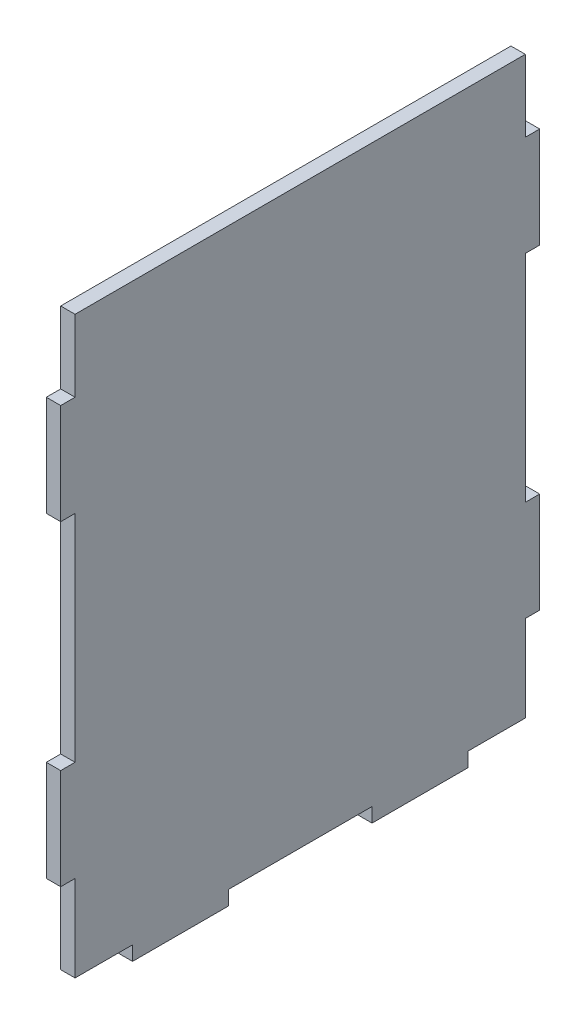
SolidWorks part; units mm, degrees
ref_plane "Front Plane" through (0, 0, 0) normal (0, 0, 1) x (1, 0, 0)
ref_plane "Top Plane" through (0, 0, 0) normal (0, 1, 0) x (1, 0, 0)
ref_plane "Right Plane" through (0, 0, 0) normal (1, 0, 0) x (0, 0, -1)
sketch "草图1" plane through (0, 0, 0) normal (1, 0, 0) x (0, 0, -1)
  line L0 (-50, 60) -> (-50, -60)
  line L1 (-50, -60) -> (50, -60)
  line L2 (50, -60) -> (50, 60)
  line L3 (50, 60) -> (-50, 60)
  point P4 (0, 60)
  point P5 (-50, 0)
  dimension "D1" = 120
  dimension "D2" = 100
extrude "凸台-拉伸1" add sketch "草图1" along normal blind 3
sketch "草图2" plane through (3, 0, 0) normal (1, 0, 0) x (0, 0, -1)
  line L0 (50, 24) -> (47, 24)
  line L1 (50, -60) -> (50, 60) construction
  line L2 (47, 24) -> (47, -21)
  line L3 (47, -21) -> (50, -21)
  line L4 (50, -21) -> (50, 24)
  line L5 (50, -42) -> (47, -42)
  line L6 (47, -42) -> (47, -60)
  line L7 (-50, -60) -> (50, -60) construction
  line L8 (47, -60) -> (50, -60)
  line L9 (50, -60) -> (50, -42)
  line L10 (47, 60) -> (47, 45)
  line L11 (50, 60) -> (-50, 60) construction
  line L12 (47, 45) -> (50, 45)
  line L13 (50, 45) -> (50, 60)
  line L14 (50, 60) -> (47, 60)
  line L15 (0, 60) -> (0, -60) construction
  line L16 (-50, 60) -> (-47, 60)
  line L17 (-50, 45) -> (-50, 60)
  line L18 (-47, 45) -> (-50, 45)
  line L19 (-47, 60) -> (-47, 45)
  line L20 (-50, -60) -> (-50, -42)
  line L21 (-47, -60) -> (-50, -60)
  line L22 (-47, -42) -> (-47, -60)
  line L23 (-50, -42) -> (-47, -42)
  line L24 (-50, -21) -> (-50, 24)
  line L25 (-47, -21) -> (-50, -21)
  line L26 (-47, 24) -> (-47, -21)
  line L27 (-50, 24) -> (-47, 24)
  dimension "D1" = 45
  dimension "D2" = 21
  dimension "D3" = 18
  dimension "D4" = 21
  dimension "D5" = 3
  dimension "D6" = 3
extrude "切除-拉伸2" cut sketch "草图2" against normal blind 3
sketch "草图4" plane through (3, 0, 0) normal (1, 0, 0) x (0, 0, -1)
  line L0 (-35, -60) -> (-35, -63)
  line L1 (-47, -60) -> (47, -60) construction
  line L2 (-35, -63) -> (-15, -63)
  line L3 (-15, -63) -> (-15, -60)
  line L4 (-15, -60) -> (-35, -60)
  line L5 (15, -60) -> (15, -63)
  line L6 (15, -63) -> (35, -63)
  line L7 (35, -63) -> (35, -60)
  line L8 (35, -60) -> (15, -60)
  line L9 (47, -42) -> (47, -60) construction
  line L10 (-47, -60) -> (-47, -42) construction
  dimension "D1" = 12
  dimension "D2" = 20
  dimension "D3" = 3
  dimension "D4" = 3
  dimension "D5" = 20
  dimension "D6" = 12
extrude "凸台-拉伸3" add sketch "草图4" against normal blind 3
